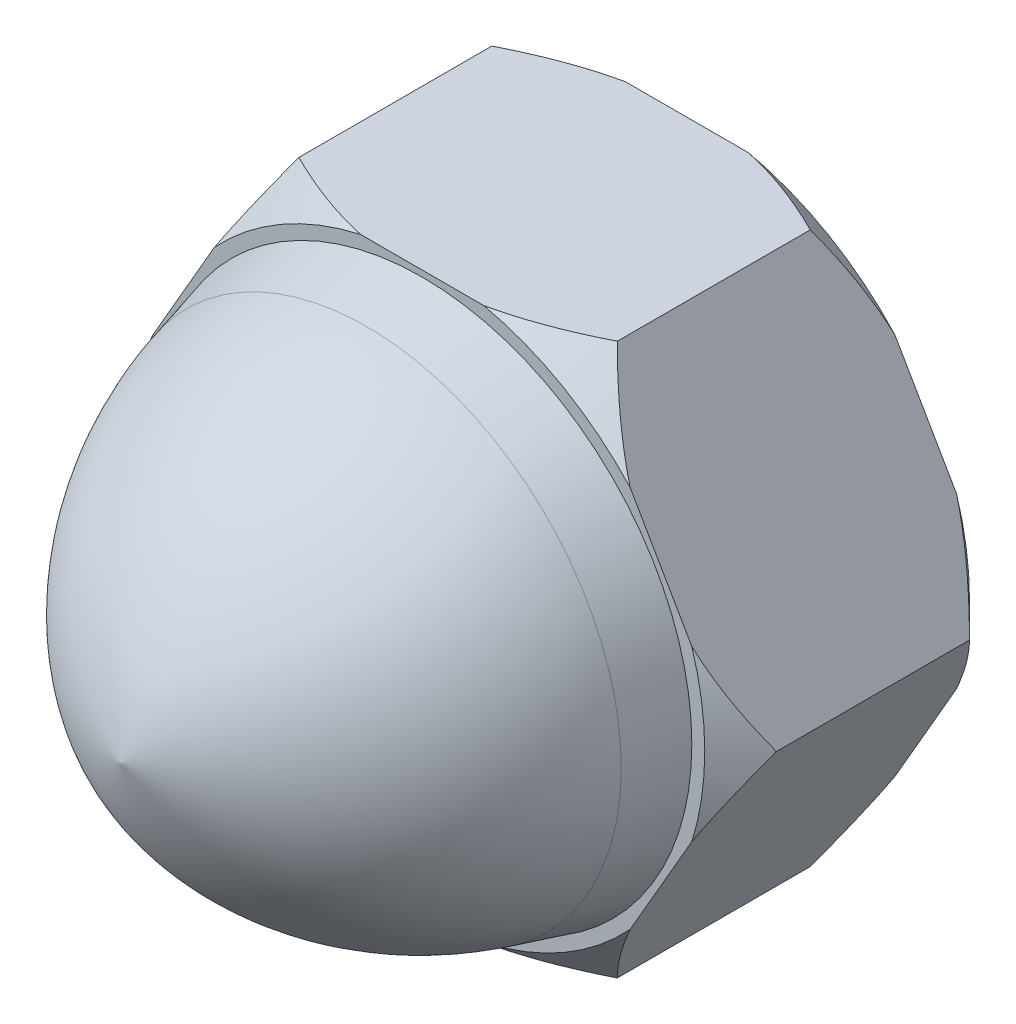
SolidWorks part; units mm, degrees
ref_plane "Plane1" through (0, 0, 0) normal (0, 0, 1) x (1, 0, 0)
ref_plane "Plane2" through (0, 0, 0) normal (0, 1, 0) x (1, 0, 0)
ref_plane "Plane3" through (0, 0, 0) normal (1, 0, 0) x (0, 0, -1)
sketch "Esquisse1" plane through (0, 0, 0) normal (0, 0, 1) x (1, 0, 0)
  line L0 (0, 0) -> (7.0717, 0) construction
  line L1 (-2.8868, 5) -> (2.8868, 5)
  line L2 (-2.8868, -5) -> (2.8868, -5)
  line L3 (5.7735, 0) -> (2.8868, -5)
  line L4 (-5.7735, 0) -> (-2.8868, -5)
  line L5 (-2.8868, 5) -> (-5.7735, 0)
  line L6 (2.8868, 5) -> (5.7735, 0)
  dimension "D1" = 120
  dimension "D2" = 120
  dimension "D3" = 5
  dimension "D4" = 5
  dimension "D5" = 120
  dimension "D6" = 120
  dimension "D7" = 5
  dimension "D8" = 5
  dimension "D9" = 5
extrude "Base-Extrusion" add sketch "Esquisse1" against normal blind 4.8
sketch "Esquisse2" plane through (0, 0, 0) normal (0, 1, 0) x (1, 0, 0)
  line L0 (5.7735, 0.65) -> (5.7735, 0)
  line L1 (5.7735, 4.8) -> (5.7735, 0) construction
  line L2 (5.7735, 0) -> (5.1235, 0)
  line L3 (2.8868, 0) -> (5.7735, 0) construction
  line L4 (5.1235, 0) -> (5.7735, 0.65)
  dimension "D1" = 0.65
  dimension "D2" = 0.65
sketch "Esquisse3" plane through (0, 0, 0) normal (0, 0, 1) x (1, 0, 0)
  circle A0 centre (0, 0) radius 4
  dimension "D1" = 8
sweep "Couper-Balayage1" cut profiles "Esquisse2" path "Esquisse3"
sketch "Esquisse5" plane through (0, 0, 0) normal (0, 1, 0) x (1, 0, 0)
  line L0 (-5.7735, 4.8) -> (-5.7735, 4.15)
  line L1 (-5.7735, 4.15) -> (-5.1235, 4.8)
  line L2 (-2.8868, 4.8) -> (-5.7735, 4.8) construction
  line L3 (-5.1235, 4.8) -> (-5.7735, 4.8)
  dimension "D1" = 0.65
  dimension "D2" = 0.65
sketch "Esquisse6" plane through (0, 0, -4.8) normal (0, 0, -1) x (-1, 0, 0)
  circle A0 centre (0, 0) radius 4
  dimension "D1" = 8
sweep "Couper-Balayage2" cut profiles "Esquisse5" path "Esquisse6"
sketch "Esquisse10" plane through (0, 0, -4.8) normal (0, 0, -1) x (-1, 0, 0)
  circle A0 centre (0, 0) radius 2.5
  dimension "D1" = 5
extrude "Couper-Extrusion1" cut sketch "Esquisse10" against normal blind 6.5
sketch "Esquisse18" plane through (0, 0, 0) normal (0, 1, 0) x (1, 0, 0)
  line L0 (0, 0) -> (0, -5.4793)
  line L1 (0, 0) -> (-4.8892, 0)
  line L2 (-4.8892, 0) -> (-4.6186, -1.01)
  arc A0 (-4.6186, -1.01) -> (0, -5.4793) centre (1.4185, 0.6076) ccw
  dimension "D1" = 12.5
  dimension "D2" = 15
sketch "Esquisse19" plane through (0, 0, 0) normal (0, 0, 1) x (1, 0, 0)
  circle A0 centre (0, 0) radius 4.8892
sweep "Bossage-Balayage8" add profiles "Esquisse18" path "Esquisse19"
